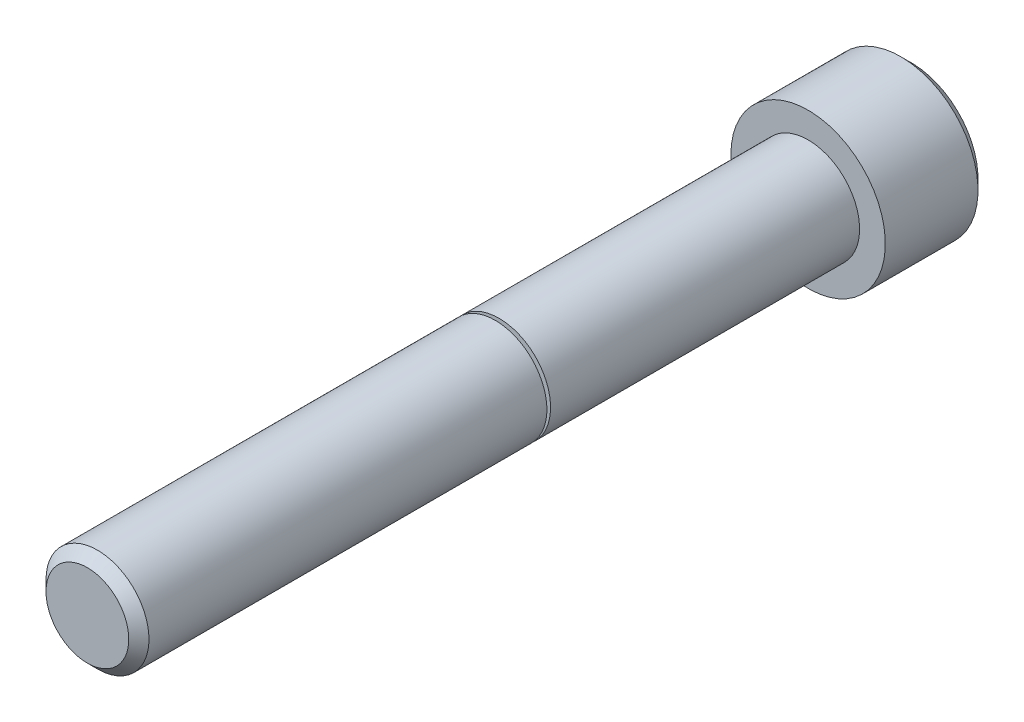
SolidWorks part; units mm, degrees
ref_plane "Front" through (0, 0, 0) normal (0, 0, 1) x (1, 0, 0)
ref_plane "Top" through (0, 0, 0) normal (0, 1, 0) x (1, 0, 0)
ref_plane "Right" through (0, 0, 0) normal (1, 0, 0) x (0, 0, -1)
sketch "Logo3_Revol_Axis" plane through (0, 0, 0) normal (0, 1, 0) x (1, 0, 0)
  line L0 (0, -43.5172) -> (0, 43.5172) construction
sketch "Logo3_bib1" plane through (0, 0, 0) normal (0, -1, 0) x (-1, 0, 0)
  line L0 (0, -44.45) -> (0, 6.35)
  line L1 (0, 6.35) -> (4.1275, 6.35)
  line L2 (4.7625, 5.715) -> (4.7625, 0)
  line L3 (4.7625, 0) -> (3.175, 0)
  line L4 (3.175, 0) -> (3.175, -19.06)
  line L5 (3.175, -43.8277) -> (2.5527, -44.45)
  line L6 (2.5527, -44.45) -> (0, -44.45)
  line L7 (3.175, -19.06) -> (2.6661, -19.06)
  line L8 (2.6593, -19.0988) -> (3.175, -19.2865)
  line L9 (3.175, -19.2865) -> (3.175, -43.8277)
  line L10 (0, 10.5852) -> (0, -63.2873) construction
  line L11 (4.1275, 6.35) -> (4.7625, 5.715)
  arc A1 (2.6661, -19.06) -> (2.6593, -19.0988) centre (2.6661, -19.08) ccw
  point P17 (2.5527, -19.06)
  point P19 (4.7625, 6.35)
revolve "Revolve1" add sketch "Logo3_bib1" angle 360 about L10
sketch "Logo3_bib2" plane through (0, 0, -6.35) normal (0, 0, -1) x (1, 0, 0)
  line L1 (2.7496, 0) -> (1.3748, 2.3813)
  line L2 (1.3748, 2.3813) -> (-1.3748, 2.3813)
  line L3 (-1.3748, 2.3813) -> (-2.7496, 0)
  line L4 (-2.7496, 0) -> (-1.3748, -2.3813)
  line L5 (-1.3748, -2.3813) -> (1.3748, -2.3813)
  line L6 (1.3748, -2.3813) -> (2.7496, 0)
  circle A0 centre (0, 0) radius 2.3812 construction
  dimension "Logo3_c1" = 4.7625
extrude "Cut-Extrude1" cut sketch "Logo3_bib2" against normal blind 3.175
equation "\"DIA2@Logo3_bib1\" = \"Logo3_d1-pas@Logo3_bib1\""
equation "\"LGT1@Logo3_bib1\" = \"Logo3_d1@Logo3_bib1\""
equation "\"D1@Cut-Extrude1\" = \"Logo3_d1@Logo3_bib1\"/2."
equation "\"D2@Cosmetic Thread1\" = \"Logo3_d1-pas@Logo3_bib1\""
equation "\"D5@Logo3_bib1\"=\"Logo3_d1@Logo3_bib1\"*.1"
